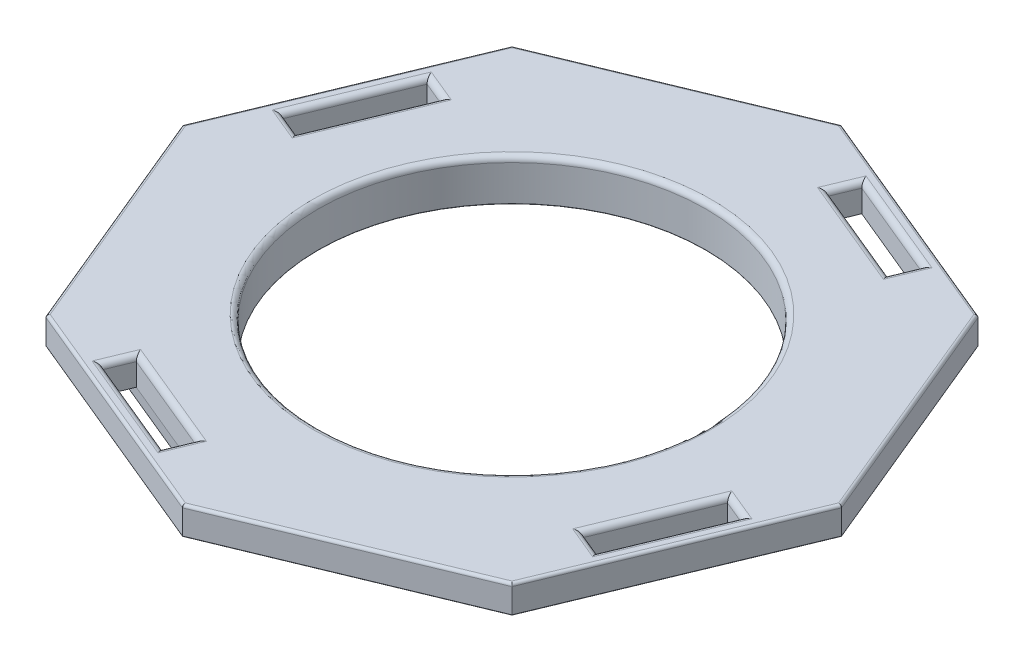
SolidWorks part; units mm, degrees
ref_plane "Front Plane" through (0, 0, 0) normal (0, 0, 1) x (1, 0, 0)
ref_plane "Top Plane" through (0, 0, 0) normal (0, 1, 0) x (1, 0, 0)
ref_plane "Right Plane" through (0, 0, 0) normal (1, 0, 0) x (0, 0, -1)
sketch "Sketch1" plane through (0, 0, 0) normal (0, 1, 0) x (1, 0, 0)
  line L1 (59.5316, 0) -> (42.0952, 42.0952)
  line L2 (42.0952, 42.0952) -> (0, 59.5316)
  line L3 (0, 59.5316) -> (-42.0952, 42.0952)
  line L4 (-42.0952, 42.0952) -> (-59.5316, 0)
  line L5 (-59.5316, 0) -> (-42.0952, -42.0952)
  line L6 (-42.0952, -42.0952) -> (0, -59.5316)
  line L7 (0, -59.5316) -> (42.0952, -42.0952)
  line L8 (42.0952, -42.0952) -> (59.5316, 0)
  circle A0 centre (0, 0) radius 55 construction
  dimension "D1" = 110
extrude "Boss-Extrude1" add sketch "Sketch1" along normal blind 5
sketch "Sketch2" plane through (0, 0, 0) normal (0, -1, 0) x (1, 0, 0)
  line L1 (51.7, 0) -> (36.5574, 36.5574)
  line L2 (36.5574, 36.5574) -> (0, 51.7)
  line L3 (0, 51.7) -> (-36.5574, 36.5574)
  line L4 (-36.5574, 36.5574) -> (-51.7, 0)
  line L5 (-51.7, 0) -> (-36.5574, -36.5574)
  line L6 (-36.5574, -36.5574) -> (0, -51.7)
  line L7 (0, -51.7) -> (36.5574, -36.5574)
  line L8 (36.5574, -36.5574) -> (51.7, 0)
  circle A0 centre (0, 0) radius 47.7646 construction
  dimension "D1" = 103.4
extrude "Boss-Extrude2" add sketch "Sketch2" along normal blind 2.5 draft 6.5
sketch "Sketch4" plane through (0, 5, 0) normal (0, 1, 0) x (1, 0, 0)
  circle A0 centre (0, 0) radius 35
extrude "Cut-Extrude1" cut sketch "Sketch4" against normal blind 26.5
sketch "Sketch7" plane through (0, 5, 0) normal (0, 1, 0) x (1, 0, 0)
  line L0 (21.0476, 50.8134) -> (20.1291, 48.5961) construction
  line L1 (42.0952, 42.0952) -> (0, 59.5316) construction
  line L2 (20.1291, 48.5961) -> (18.2923, 44.1614) construction
  line L3 (9.0535, 47.9883) -> (27.5311, 40.3346)
  line L4 (9.0535, 47.9883) -> (10.8521, 52.3305)
  line L5 (10.8521, 52.3305) -> (29.3297, 44.6768)
  line L6 (29.3297, 44.6768) -> (27.5311, 40.3346)
  line L7 (-47.9883, 9.0535) -> (-52.3305, 10.8521)
  line L8 (-47.9883, 9.0535) -> (-40.3346, 27.5311)
  line L9 (-52.3305, 10.8521) -> (-44.6768, 29.3297)
  line L10 (-44.6768, 29.3297) -> (-40.3346, 27.5311)
  line L11 (-9.0535, -47.9883) -> (-10.8521, -52.3305)
  line L12 (-9.0535, -47.9883) -> (-27.5311, -40.3346)
  line L13 (-10.8521, -52.3305) -> (-29.3297, -44.6768)
  line L14 (-29.3297, -44.6768) -> (-27.5311, -40.3346)
  line L15 (47.9883, -9.0535) -> (52.3305, -10.8521)
  line L16 (47.9883, -9.0535) -> (40.3346, -27.5311)
  line L17 (52.3305, -10.8521) -> (44.6768, -29.3297)
  line L18 (44.6768, -29.3297) -> (40.3346, -27.5311)
  point P24 (-1.1055, 2.8012)
  point P25 (0, 0)
  dimension "D1" = 4.7
  dimension "D2" = 2.5
  dimension "D3" = 20
  dimension "D4" = 4
extrude "Cut-Extrude2" cut sketch "Sketch7" against normal through all
fillet "Fillet6" radius 1 16 edges at (-42.5057, 5, -28.4304) (-44.1614, 5, -18.2923) (-48.5037, 5, -20.0909) (-50.1594, 5, -9.9528) (-18.2923, 5, 44.1614) (-28.4304, 5, 42.5057) (-20.0909, 5, 48.5037) (-9.9528, 5, 50.1594) (42.5057, 5, 28.4304) (48.5037, 5, 20.0909) (44.1614, 5, 18.2923) (50.1594, 5, 9.9528) (28.4304, 5, -42.5057) (18.2923, 5, -44.1614) (9.9528, 5, -50.1594) (20.0909, 5, -48.5037)
fillet "Fillet7" radius 1 1 edges at (0, 5, 35)
fillet "Fillet8" radius 0.5 8 edges at (21.0476, 5, 50.8134) (-21.0476, 5, 50.8134) (-50.8134, 5, 21.0476) (-50.8134, 5, -21.0476) (-21.0476, 5, -50.8134) (21.0476, 5, -50.8134) (50.8134, 5, -21.0476) (50.8134, 5, 21.0476)
fillet "Fillet9" radius 0.1 33 edges at (-41.9831, 4.8536, 41.9831) (-59.3731, 4.8536, 0) (-41.9831, 4.8536, -41.9831) (0, 4.8536, -59.3731) (41.9831, 4.8536, -41.9831) (59.3731, 4.8536, 0) (0, 4.8536, 59.3731) (41.9831, 4.8536, 41.9831) (-21.0476, 0, 50.8134) (-50.8134, 0, 21.0476) (-42.0952, 2.25, 42.0952) (-50.8134, 0, -21.0476) (-59.5316, 2.25, 0) (-21.0476, 0, -50.8134) (-42.0952, 2.25, -42.0952) (21.0476, 0, -50.8134) (0, 2.25, -59.5316) (50.8134, 0, -21.0476) (42.0952, 2.25, -42.0952) (50.8134, 0, 21.0476) (59.5316, 2.25, 0) (21.0476, 0, 50.8134) (0, 2.25, 59.5316) (42.0952, 2.25, 42.0952) (18.1697, -2.5, -43.8656) (-18.1697, -2.5, -43.8656) (-43.8656, -2.5, -18.1697) (-43.8656, -2.5, 18.1697) (-18.1697, -2.5, 43.8656) (18.1697, -2.5, 43.8656) (43.8656, -2.5, 18.1697) (43.8656, -2.5, -18.1697) (0, -2.5, -35)
